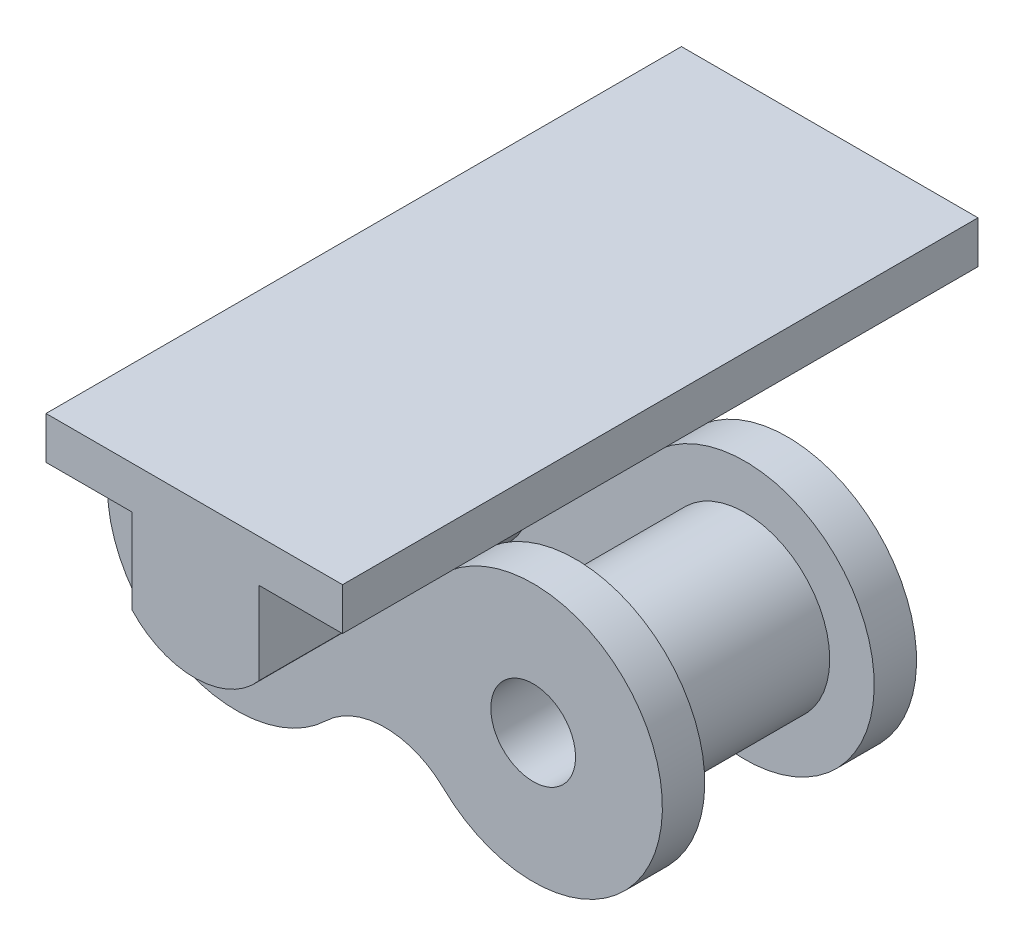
SolidWorks part; units mm, degrees
ref_plane "Alzado" through (0, 0, 0) normal (0, 0, 1) x (1, 0, 0)
ref_plane "Planta" through (0, 0, 0) normal (0, 1, 0) x (1, 0, 0)
ref_plane "Vista lateral" through (0, 0, 0) normal (1, 0, 0) x (0, 0, -1)
sketch "Croquis1" plane through (0, 0, 0) normal (0, 0, 1) x (1, 0, 0)
  line L0 (0, 8.0804) -> (0, 3.2808) construction
  line L1 (-13.3325, 0) -> (12.5534, 0) construction
  line L2 (0, -3.2808) -> (0, -10.9407) construction
  arc A6 (-2.7723, 4.3973) -> (-2.7723, -4.3973) centre (-7, 0) ccw
  circle A7 centre (-7, 0) radius 2
  arc A8 (2.7723, 4.3973) -> (2.7723, -4.3973) centre (7, 0) cw
  circle A9 centre (7, 0) radius 2
  arc A10 (-2.7723, 4.3973) -> (2.7723, 4.3973) centre (0, 7.2808) ccw
  arc A11 (-2.7723, -4.3973) -> (2.7723, -4.3973) centre (0, -7.2808) cw
  dimension "D1" = 12.2
  dimension "D2" = 4
  dimension "D4" = 4
  dimension "D3" = 7
extrude "Saliente-Extruir1" add sketch "Croquis1" along normal blind 2
sketch "Croquis2" plane through (0, 0, 2) normal (0, 0, 1) x (1, 0, 0)
  circle A0 centre (7, 0) radius 2 construction
  circle A1 centre (-7, 0) radius 2 construction
  circle A2 centre (7, 0) radius 2
  circle A3 centre (-7, 0) radius 2
  circle A12 centre (-7, 0) radius 4
  circle A13 centre (7, 0) radius 4
  dimension "D1" = 8
extrude "Saliente-Extruir2" add sketch "Croquis2" along normal blind 8
ref_plane "Plano1" through (0, 0, 6) normal (0, 0, 1) x (1, 0, 0)
mirror "Simetría1" about plane through (0, 0, 6) normal (0, 0, 1) of "Saliente-Extruir1"
sketch "Croquis3" plane through (0, 0, 12) normal (0, 0, 1) x (1, 0, 0)
  line L0 (0, 0) -> (0, 12.5285) construction
  line L2 (-2.9385, 4.5513) -> (-2.9385, 8.5513)
  line L4 (3.0615, 4.6581) -> (3.0615, 8.5513)
  line L5 (-7, 8.5513) -> (-2.9385, 8.5513)
  line L6 (-7, 8.5513) -> (-7, 10.5513)
  line L7 (-7, 10.5513) -> (7, 10.5513)
  line L8 (7, 8.5513) -> (7, 10.5513)
  line L9 (3.0615, 8.5513) -> (7, 8.5513)
  arc A0 (-2.7723, 4.3973) -> (-2.7723, -4.3973) centre (-7, 0) ccw construction
  arc A2 (2.7723, -4.3973) -> (2.7723, 4.3973) centre (7, 0) ccw construction
  arc A3 (-2.9385, 4.5513) -> (3.0615, 4.6581) centre (0.0144, 7.2495) ccw
  point P17 (0, 10.5513)
  dimension "D6" = 4
  dimension "D1" = 4
  dimension "D2" = 6
  dimension "D3" = 2
  dimension "D4" = 14
  dimension "D5" = 0.2892
extrude "Saliente-Extruir3" add sketch "Croquis3" against normal blind 21 and the other way blind 9
